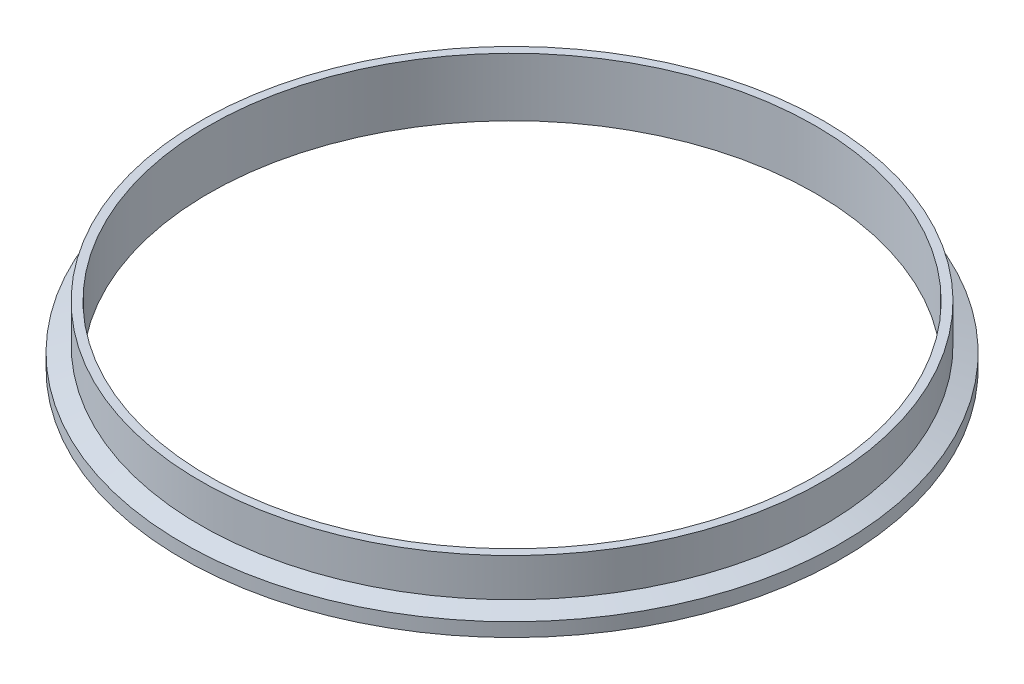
SolidWorks part; units mm, degrees
ref_plane "Front Plane" through (0, 0, 0) normal (0, 0, 1) x (1, 0, 0)
ref_plane "Top Plane" through (0, 0, 0) normal (0, 1, 0) x (1, 0, 0)
ref_plane "Right Plane" through (0, 0, 0) normal (1, 0, 0) x (0, 0, -1)
sketch "Sketch1" plane through (0, 0, 0) normal (0, 0, 1) x (1, 0, 0)
  line L0 (0, 0) -> (0, 23.8125) construction
  line L1 (0, 23.8125) -> (-127, 23.8125)
  line L2 (-127, 23.8125) -> (-127, 8.2228)
  line L3 (-127, 8.2228) -> (-134.239, 5.588)
  line L4 (-134.239, 5.588) -> (-134.239, 0)
  line L5 (-134.239, 0) -> (-130.7992, 0)
  line L6 (-127.1632, 0) -> (0, 0)
  line L7 (0, 0) -> (0, 23.8125)
  line L8 (0, 23.8125) -> (-123.5964, 23.8125)
  line L9 (-123.5964, 23.8125) -> (-123.5964, 0)
  line L10 (-123.5964, 0) -> (0, 0)
  line L11 (0, 0) -> (-0.1846, 0.0129)
  arc A0 (-130.0767, 0.4745) -> (-127.8857, 0.4745) centre (-128.9812, 0) cw
  arc A1 (-127.1632, 0) -> (-127.8857, 0.4745) centre (-127.1632, 0.7874) cw
  arc A2 (-130.0767, 0.4745) -> (-130.7992, 0) centre (-130.7992, 0.7874) cw
  point P12 (-127.7874, 0)
  dimension "D6" = 1.1938
  dimension "D7" = 0.7874
  dimension "3.00" = 127
  dimension "D2" = 5.588
  dimension "D3" = 134.239
  dimension "D4" = 70
  dimension "D5" = 128.9812
  dimension "D8" = 3.4036
  dimension "D9" = 23.8125
revolve "Revolve2" add sketch "Sketch1" angle 360 about L0
